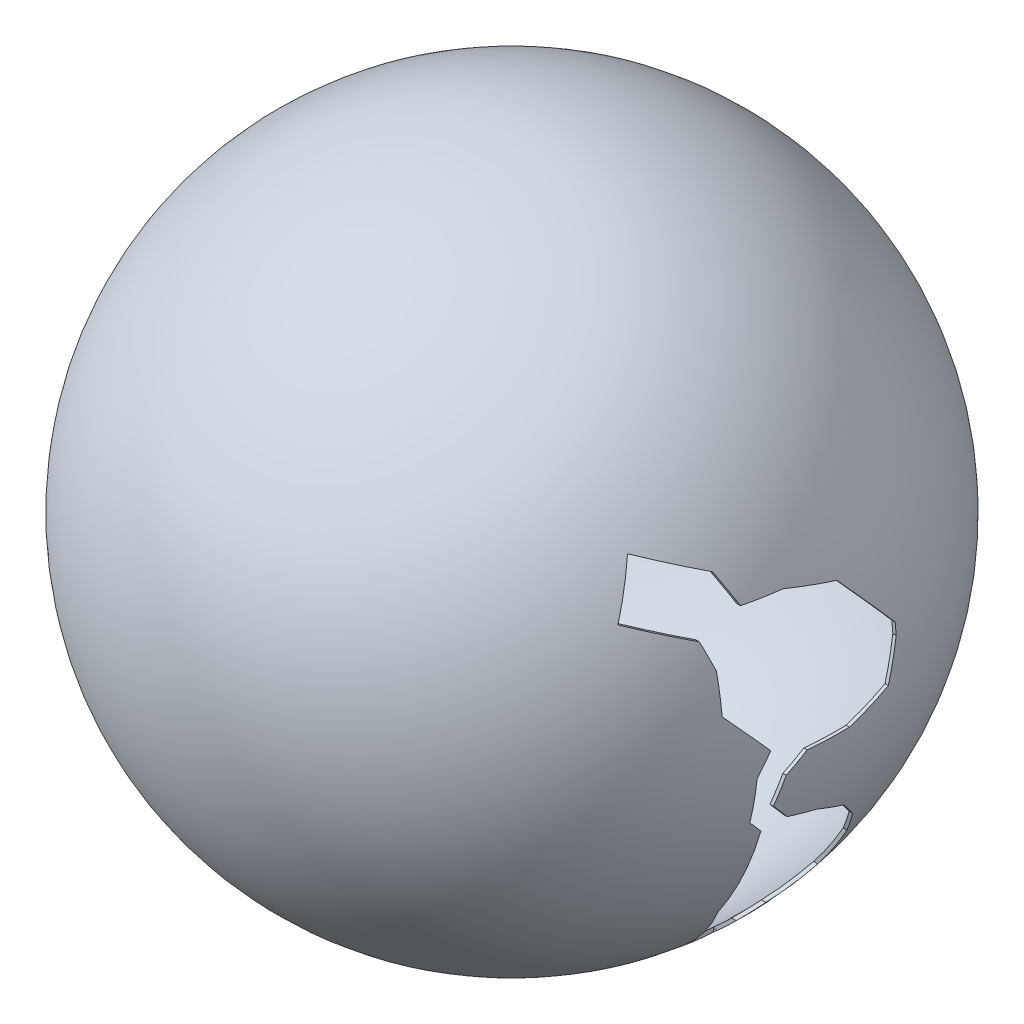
SolidWorks part; units mm, degrees
ref_plane "Plane1 x-y" through (0, 0, 0) normal (0, 0, 1) x (1, 0, 0)
ref_plane "Plane2 x-z" through (0, 0, 0) normal (0, 1, 0) x (1, 0, 0)
ref_plane "Plane3 y-z" through (0, 0, 0) normal (1, 0, 0) x (0, 0, -1)
sketch "Sketch1" plane through (0, 0, 0) normal (0, 0, 1) x (1, 0, 0)
  line L0 (0, 47.2239) -> (0, -54.2201) construction
  line L1 (0, 100) -> (0, 99)
  line L2 (0, -99) -> (0, -100)
  arc A0 (0, 100) -> (0, -100) centre (0, 0) cw
  arc A1 (0, 99) -> (0, -99) centre (0, 0) cw
  dimension "D1" = 100
  dimension "D2" = 1
revolve "Revolve1" add sketch "Sketch1" angle 360 about L0
ref_plane "Plane1" through (139.9876, 0, 0) normal (1, 0, 0) x (0, 0, -1)
sketch "Sketch2" plane through (139.9876, 0, 0) normal (1, 0, 0) x (0, 0, -1)
  line L0 (-41.8333, 48.3998) -> (-33.4172, 44.4392)
  line L1 (-33.4172, 44.4392) -> (-26.4315, 41.1518)
  line L2 (-26.4315, 41.1518) -> (-22.5256, 32.5575)
  line L3 (-22.5256, 32.5575) -> (-11.6341, 32.5575)
  line L4 (-11.6341, 32.5575) -> (2.7229, 28.597)
  line L5 (2.7229, 28.597) -> (10.1489, 20.1808)
  line L6 (10.1489, 20.1808) -> (18.5285, 10.684)
  line L7 (18.5285, 10.684) -> (18.5285, 7.309)
  line L8 (18.5285, 7.309) -> (15.4239, -3.9451)
  line L9 (15.4239, -3.9451) -> (2.7229, -8.0381)
  line L10 (2.7229, -8.0381) -> (-9.6538, -8.0381)
  line L11 (-9.6538, -8.0381) -> (-14.8935, -12.6613)
  line L12 (-14.8935, -12.6613) -> (-17.0799, -20.587)
  line L13 (-17.0799, -20.587) -> (-12.3301, -25.9701)
  line L14 (-12.3301, -25.9701) -> (-3.4655, -28.4155)
  line L15 (-3.4655, -28.4155) -> (6.4359, -33.075)
  line L16 (6.4359, -33.075) -> (12.5565, -40.0117)
  line L17 (12.5565, -40.0117) -> (15.0643, -47.7936)
  line L18 (15.0643, -47.7936) -> (15.0643, -61.1264)
  line L19 (15.0643, -61.1264) -> (9.0734, -63.057)
  line L20 (9.0734, -63.057) -> (1.4852, -65.5024)
  line L21 (1.4852, -65.5024) -> (-3.4655, -69.8707)
  line L22 (-3.4655, -69.8707) -> (-3.4655, -75.3675)
  line L23 (-3.4655, -75.3675) -> (-6.809, -82.4724)
  line L24 (-6.809, -82.4724) -> (-12.3301, -82.4724)
  line L25 (-12.3301, -82.4724) -> (-12.3301, -75.3675)
  line L26 (-12.3301, -75.3675) -> (-14.705, -67.998)
  line L27 (-14.705, -67.998) -> (-18.8713, -55.0697)
  line L28 (-18.8713, -55.0697) -> (-18.8713, -47.4506)
  line L29 (-18.8713, -47.4506) -> (-18.8713, -35.2669)
  line L30 (-18.8713, -35.2669) -> (-18.8713, -27.1928)
  line L31 (-18.8713, -27.1928) -> (-22.5256, -23.0512)
  line L32 (-22.5256, -23.0512) -> (-22.5256, -16.6242)
  line L33 (-22.5256, -16.6242) -> (-22.5256, -10.3497)
  line L34 (-22.5256, -10.3497) -> (-19.5117, -3.9451)
  line L35 (-19.5117, -3.9451) -> (-25.9231, 3.3211)
  line L36 (-25.9231, 3.3211) -> (-30.9308, 8.9965)
  line L37 (-30.9308, 8.9965) -> (-30.9308, 20.1808)
  line L38 (-30.9308, 20.1808) -> (-33.336, 27.6445)
  line L39 (-33.336, 27.6445) -> (-39.8729, 30.7207)
  line L40 (-39.8729, 30.7207) -> (-48.2891, 34.6813)
  line L41 (-48.2891, 34.6813) -> (-45.5919, 40.4127)
  line L42 (-45.5919, 40.4127) -> (-41.8333, 48.3998)
extrude "Extrude4" add sketch "Sketch2" against normal blind 75.2 separate body
combine bodies "Combine1" operation type subtract main body 104 bodies to subtract 106
